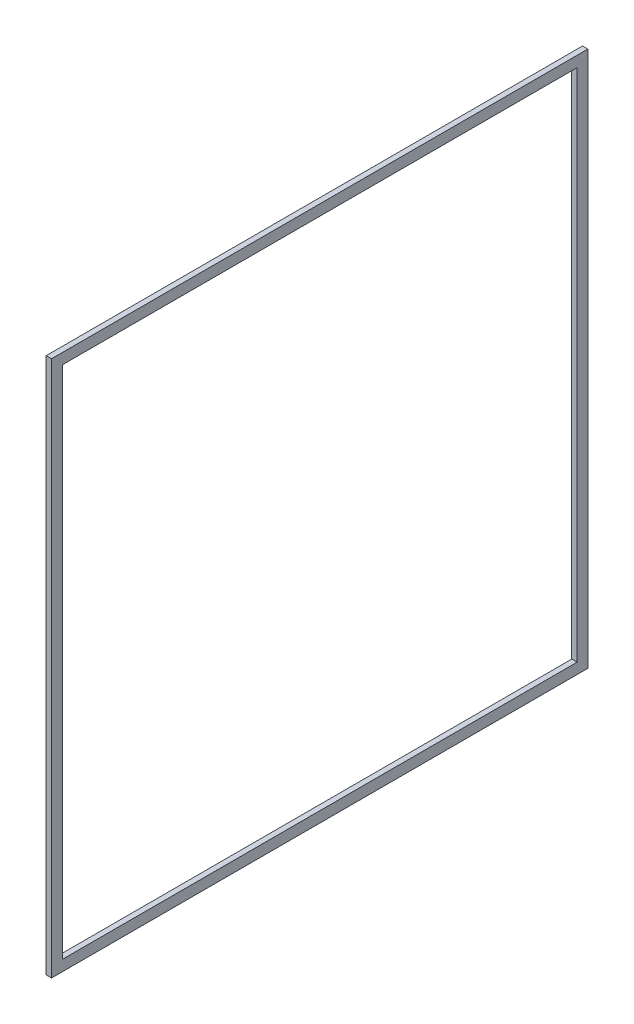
SolidWorks part; units mm, degrees
ref_plane "Front Plane" through (0, 0, 0) normal (1, 0, 0) x (0, 1, 0)
ref_plane "Top Plane" through (0, 0, 0) normal (0, 0, 1) x (0, 1, 0)
ref_plane "Right Plane" through (0, 0, 0) normal (0, 1, 0) x (-1, 0, 0)
sketch "Sketch1" plane through (0, 0, 0) normal (1, 0, 0) x (0, 1, 0)
  line L0 (-158.75, 152.4) -> (158.75, 152.4)
  line L1 (158.75, 152.4) -> (158.75, 158.75)
  line L2 (158.75, 158.75) -> (-158.75, 158.75)
  line L3 (-158.75, 158.75) -> (-158.75, 152.4)
ref_plane "Plane1" through (3.175, 0, 0) normal (1, 0, 0) x (0, 1, 0)
sketch "Sketch2" plane through (3.175, 0, 0) normal (1, 0, 0) x (0, 1, 0)
  line L0 (-158.75, 152.4) -> (158.75, 152.4)
  line L1 (158.75, 152.4) -> (158.75, 158.75)
  line L2 (158.75, 158.75) -> (-158.75, 158.75)
  line L3 (-158.75, 158.75) -> (-158.75, 152.4)
loft "Gap_bridge_0" add profiles "Sketch1", "Sketch2"
sketch "Sketch3" plane through (0, 0, 0) normal (1, 0, 0) x (0, 1, 0)
  line L0 (-158.75, -158.75) -> (158.75, -158.75)
  line L1 (158.75, -158.75) -> (158.75, -152.4)
  line L2 (158.75, -152.4) -> (-158.75, -152.4)
  line L3 (-158.75, -152.4) -> (-158.75, -158.75)
ref_plane "Plane2" through (3.175, 0, 0) normal (1, 0, 0) x (0, 1, 0)
sketch "Sketch4" plane through (3.175, 0, 0) normal (1, 0, 0) x (0, 1, 0)
  line L0 (-158.75, -158.75) -> (158.75, -158.75)
  line L1 (158.75, -158.75) -> (158.75, -152.4)
  line L2 (158.75, -152.4) -> (-158.75, -152.4)
  line L3 (-158.75, -152.4) -> (-158.75, -158.75)
loft "Gap_bridge_1" add profiles "Sketch3", "Sketch4"
sketch "Sketch5" plane through (0, 0, 0) normal (1, 0, 0) x (0, 1, 0)
  line L0 (152.4, -152.4) -> (158.75, -152.4)
  line L1 (158.75, -152.4) -> (158.75, 152.4)
  line L2 (158.75, 152.4) -> (152.4, 152.4)
  line L3 (152.4, 152.4) -> (152.4, -152.4)
ref_plane "Plane3" through (3.175, 0, 0) normal (1, 0, 0) x (0, 1, 0)
sketch "Sketch6" plane through (3.175, 0, 0) normal (1, 0, 0) x (0, 1, 0)
  line L0 (152.4, -152.4) -> (158.75, -152.4)
  line L1 (158.75, -152.4) -> (158.75, 152.4)
  line L2 (158.75, 152.4) -> (152.4, 152.4)
  line L3 (152.4, 152.4) -> (152.4, -152.4)
loft "Gap_bridge_2" add profiles "Sketch5", "Sketch6"
sketch "Sketch7" plane through (0, 0, 0) normal (1, 0, 0) x (0, 1, 0)
  line L0 (-158.75, -152.4) -> (-152.4, -152.4)
  line L1 (-152.4, -152.4) -> (-152.4, 152.4)
  line L2 (-152.4, 152.4) -> (-158.75, 152.4)
  line L3 (-158.75, 152.4) -> (-158.75, -152.4)
ref_plane "Plane4" through (3.175, 0, 0) normal (1, 0, 0) x (0, 1, 0)
sketch "Sketch8" plane through (3.175, 0, 0) normal (1, 0, 0) x (0, 1, 0)
  line L0 (-158.75, -152.4) -> (-152.4, -152.4)
  line L1 (-152.4, -152.4) -> (-152.4, 152.4)
  line L2 (-152.4, 152.4) -> (-158.75, 152.4)
  line L3 (-158.75, 152.4) -> (-158.75, -152.4)
loft "Gap_bridge_3" add profiles "Sketch7", "Sketch8"
